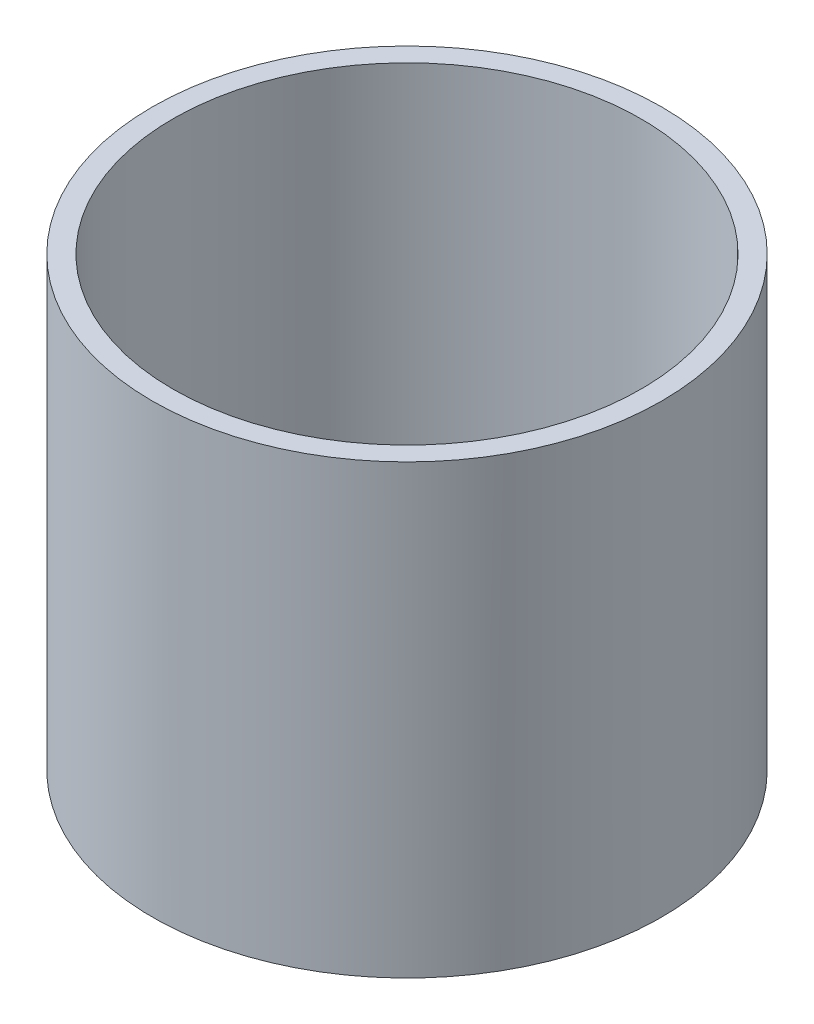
SolidWorks part; units mm, degrees
ref_plane "Front" through (0, 0, 0) normal (0, 0, 1) x (1, 0, 0)
ref_plane "Top" through (0, 0, 0) normal (0, 1, 0) x (1, 0, 0)
ref_plane "Right" through (0, 0, 0) normal (1, 0, 0) x (0, 0, -1)
sketch "Sketch1" plane through (0, 0, 0) normal (0, 1, 0) x (1, 0, 0)
  circle A0 centre (0, 0) radius 5.1816
  dimension "D1" = 10.3632
extrude "Boss-Extrude1" add sketch "Sketch1" along normal blind 7.8232
sketch "Sketch2" plane through (0, 7.8232, 0) normal (0, 1, 0) x (-1, 0, 0)
  circle A0 centre (0, 0) radius 4.7625
  dimension "D1" = 9.525
extrude "Cut-Extrude1" cut sketch "Sketch2" against normal blind 6.985
sketch "Sketch3" plane through (0, 0, 0) normal (0, -1, 0) x (1, 0, 0)
  circle A0 centre (0, 0) radius 4.0259
  dimension "D1" = 8.0518
extrude "Cut-Extrude2" cut sketch "Sketch3" against normal blind 0.508
sketch "Sketch5" plane through (0, 0, 0) normal (0, -1, 0) x (1, 0, 0)
  circle A0 centre (0, 0) radius 5.1816
extrude "Boss-Extrude2" add sketch "Sketch5" along normal blind 1.27
sketch "Sketch6" plane through (0, -1.27, 0) normal (0, -1, 0) x (1, 0, 0)
  circle A0 centre (0, 0) radius 4.0259
  dimension "D1" = 8.0518
extrude "Cut-Extrude3" cut sketch "Sketch6" against normal blind 1.27
